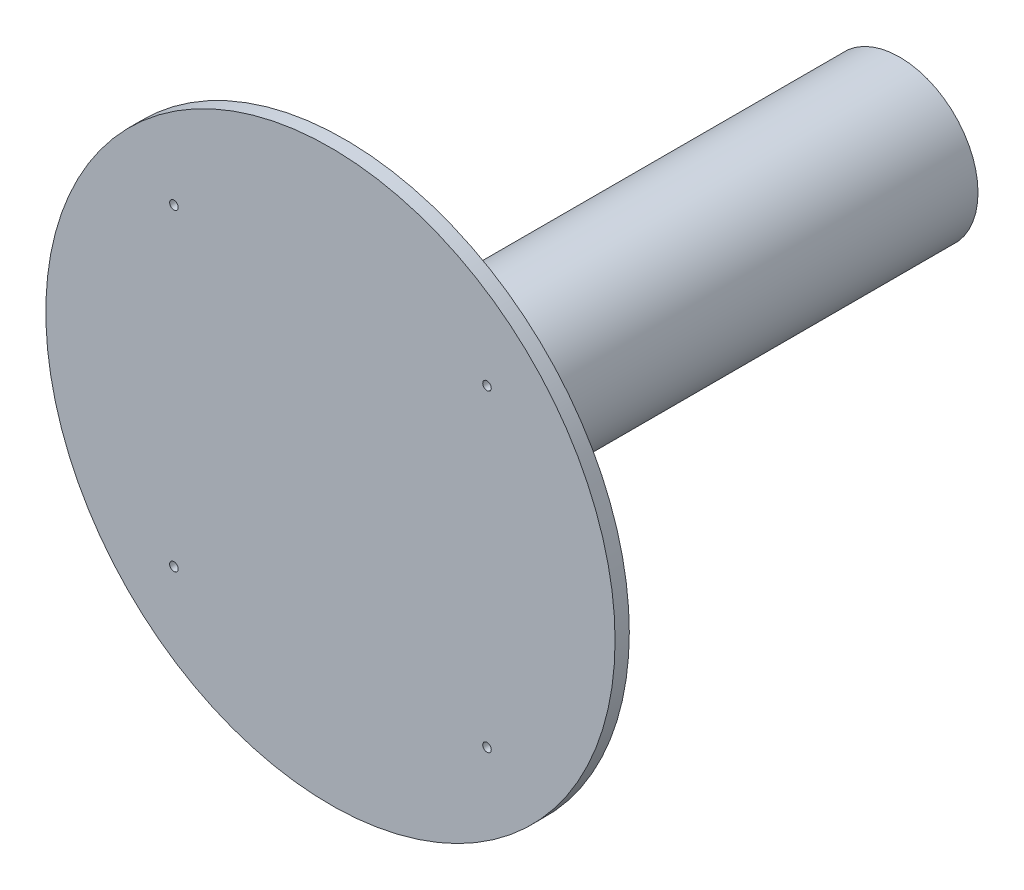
SolidWorks part; units mm, degrees
ref_plane "Front Plane" through (0, 0, 0) normal (0, 0, 1) x (1, 0, 0)
ref_plane "Top Plane" through (0, 0, 0) normal (0, 1, 0) x (1, 0, 0)
ref_plane "Right Plane" through (0, 0, 0) normal (1, 0, 0) x (0, 0, -1)
sketch "Sketch1" plane through (0, 0, 0) normal (0, 0, 1) x (1, 0, 0)
  circle A0 centre (0, 0) radius 100
  dimension "D1" = 200
extrude "Boss-Extrude1" add sketch "Sketch1" along normal blind 5
sketch "Sketch2" plane through (0, 0, 0) normal (0, 0, -1) x (-1, 0, 0)
  circle A0 centre (0, 0) radius 22.5
  circle A3 centre (0, 0) radius 27.5
  point P3 (6.0135, -6.2498)
  dimension "D2" = 5
  dimension "D1" = 45
extrude "Boss-Extrude2" add sketch "Sketch2" along normal blind 195
sketch "Sketch3" plane through (0, 0, 5) normal (0, 0, 1) x (1, 0, 0)
  line L1 (55, 55) -> (-55, 55)
  line L2 (55, 55) -> (55, -55)
  line L3 (55, -55) -> (-55, -55)
  line L4 (-55, 55) -> (-55, -55)
  line L5 (55, 55) -> (-55, -55) construction
  line L6 (55, -55) -> (-55, 55) construction
  point P0 (0, 0)
  dimension "D1" = 110
hole_wizard "Ø3.0 (3) Diameter Hole1" positions "Sketch4" profile "Sketch5" hole size "Ø3.0" standard "DIN"
sketch "Sketch4" plane through (0, 0, 5) normal (0, 0, 1) x (1, 0, 0)
  point P0 (-55, 55)
sketch "Sketch5" plane through (-55, 55, 5) normal (1, 0, 0) x (0, -1, 0)
  line L0 (0, 0) -> (0, 5)
  line L1 (0, 5) -> (1.5, 5)
  line L2 (1.5, 5) -> (1.5, 0)
  line L5 (1.5, 0) -> (0, 0)
  line L11 (0, -6.35) -> (0, 107.95) construction
  dimension "Thru Hole Dia." = 3
  dimension "Thru Hole Depth" = 5
pattern_curve "CrvPattern1" of "Ø3.0 (3) Diameter Hole1" parameters "D1"=2, "D3"=10, "D2"=2, "D4"=10
